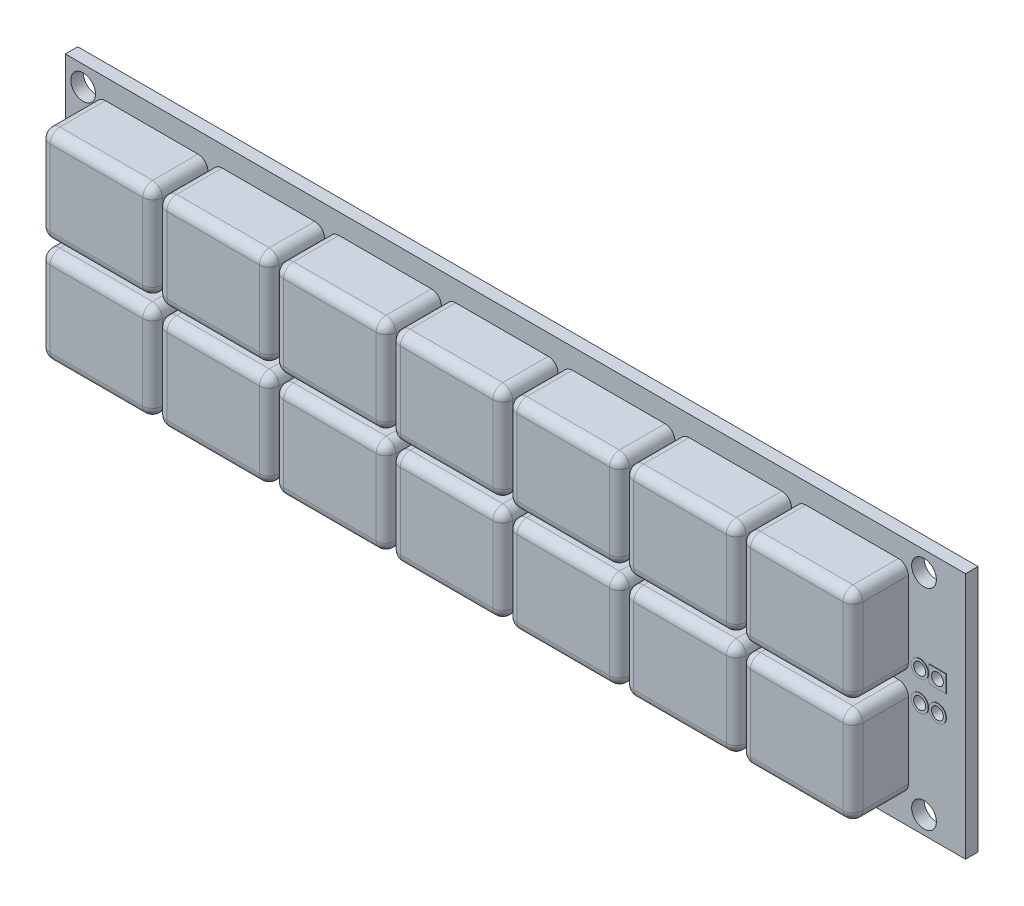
SolidWorks part; units mm, degrees
ref_plane "Front" through (0, 0, 0) normal (0, 0, 1) x (1, 0, 0)
ref_plane "Top" through (0, 0, 0) normal (0, 1, 0) x (1, 0, 0)
ref_plane "Right" through (0, 0, 0) normal (1, 0, 0) x (0, 0, -1)
sketch "Sketch1" plane through (0, 0, 0) normal (0, 0, 1) x (1, 0, 0)
  line L0 (-57.785, -15.875) -> (57.785, 15.875) construction
  line L1 (-57.785, 15.875) -> (57.785, 15.875)
  line L2 (-57.785, 15.875) -> (-57.785, -15.875)
  line L3 (-57.785, -15.875) -> (57.785, -15.875)
  line L4 (57.785, 15.875) -> (57.785, -15.875)
  dimension "D1" = 31.75
  dimension "D2" = 115.57
extrude "Base-Extrude" add sketch "Sketch1" against normal blind 1.6002
sketch "Sketch2" plane through (0, 0, 0) normal (0, 0, 1) x (1, 0, 0)
  line L0 (-57.785, 15.875) -> (-57.785, -15.875) construction
  line L1 (57.785, 15.875) -> (-57.785, 15.875) construction
  line L2 (-1.524, 43.2068) -> (-1.524, -35.8033) construction
  circle A0 centre (-55.499, 13.335) radius 1.5875
  circle A1 centre (52.451, -13.589) radius 1.5875
  circle A2 centre (52.451, 13.335) radius 1.5875
  circle A3 centre (-55.499, -13.589) radius 1.5875
  dimension "D1" = 3.175
  dimension "D7" = 53.975
  dimension "D2" = 2.54
  dimension "D3" = 2.286
  dimension "D5" = 26.924
  dimension "D6" = 2.286
extrude "Cut-Extrude1" cut sketch "Sketch2" against normal up to next
sketch "Sketch3" plane through (0, 0, 0) normal (0, 0, 1) x (1, 0, 0)
  line L0 (57.785, 15.875) -> (-57.785, 15.875) construction
  line L1 (-53.8988, 13.2588) -> (-39.4716, 13.2588)
  line L2 (-53.8988, 13.2588) -> (-53.8988, 0.9906)
  line L3 (-53.8988, 0.9906) -> (-39.4716, 0.9906)
  line L4 (-39.4716, 13.2588) -> (-39.4716, 0.9906)
  line L5 (-57.785, 15.875) -> (-57.785, -15.875) construction
  dimension "D1" = 14.4272
  dimension "D2" = 12.2682
  dimension "D3" = 2.6162
  dimension "D4" = 3.8862
extrude "Boss-Extrude1" add sketch "Sketch3" along normal blind 7.112
fillet "Fillet1" radius 1.27
pattern_linear "LPattern1" count 7 spacing 14.986 count 2 spacing 13.462
sketch "Sketch4" plane through (0, 0, 0) normal (0, 0, 1) x (1, 0, 0)
  line L0 (57.785, 15.875) -> (-57.785, 15.875) construction
  line L1 (57.785, -15.875) -> (57.785, 15.875) construction
  circle A0 centre (51.943, 2.413) radius 0.762
  dimension "D3" = 1.524
  dimension "D1" = 13.462
  dimension "D2" = 5.842
extrude "Cut-Extrude2" cut sketch "Sketch4" against normal up to next
pattern_linear "LPattern2" count 2 spacing 2.286 count 2 spacing 3.81
sketch "Sketch6" plane through (0, 0, 0) normal (0, 0, 1) x (1, 0, 0)
  line L0 (53.1241, 1.3081) -> (55.3339, 3.5179) construction
  line L1 (53.1241, 3.5179) -> (55.3339, 3.5179)
  line L2 (53.1241, 3.5179) -> (53.1241, 1.3081)
  line L3 (53.1241, 1.3081) -> (55.3339, 1.3081)
  line L4 (55.3339, 3.5179) -> (55.3339, 1.3081)
  circle A0 centre (51.943, 2.413) radius 1.1049
  circle A1 centre (51.943, -1.397) radius 1.1049
  circle A2 centre (54.229, -1.397) radius 1.1049
  circle A3 centre (51.943, 2.413) radius 0.762 construction
  circle A4 centre (51.943, -1.397) radius 0.762 construction
  circle A5 centre (54.229, -1.397) radius 0.762 construction
  circle A6 centre (51.943, 2.413) radius 0.762
  circle A7 centre (51.943, -1.397) radius 0.762
  circle A8 centre (54.229, -1.397) radius 0.762
  circle A10 centre (54.229, 2.413) radius 0.762 construction
  circle A11 centre (54.229, 2.413) radius 0.762
  point P19 (54.229, 2.413)
  dimension "D1" = 2.2098
  dimension "D2" = 2.2098
extrude "Boss-Extrude2" add sketch "Sketch6" along normal blind 0.0508
